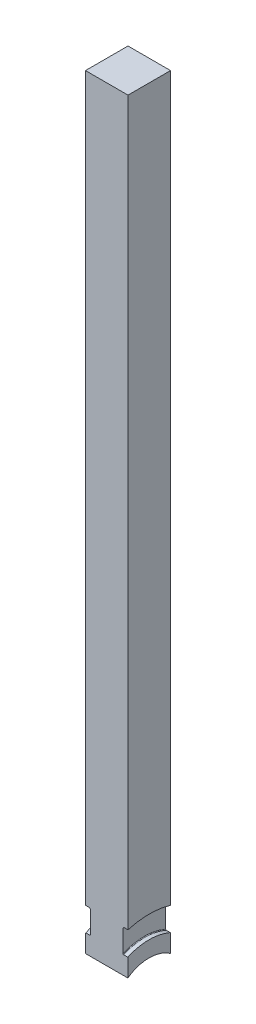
SolidWorks part; units mm, degrees
ref_plane "Front Plane" through (0, 0, 0) normal (0, 0, 1) x (1, 0, 0)
ref_plane "Top Plane" through (0, 0, 0) normal (0, 1, 0) x (1, 0, 0)
ref_plane "Right Plane" through (0, 0, 0) normal (1, 0, 0) x (0, 0, -1)
sketch "Sketch1" plane through (0, 0, 0) normal (1, 0, 0) x (0, 0, -1)
  line L0 (-12.827, 479.425) -> (-12.827, 0)
  line L1 (0, 249.2329) -> (0, 0) construction
  line L2 (12.827, 479.425) -> (12.827, 0)
  line L3 (-12.827, 479.425) -> (12.827, 479.425)
  line L6 (-12.827, 0) -> (12.827, 0)
  arc A0 (-22.225, 0) -> (22.225, 0) centre (0, 0) cw construction
  dimension "R" = 22.225
  dimension "L" = 457.2
  dimension "T" = 25.654
extrude "Boss-Extrude1" add sketch "Sketch1" along normal mid plane 25.654
sketch "Sketch8" plane through (0, 0, 0) normal (1, 0, 0) x (0, 0, -1)
  circle A0 centre (0, 0) radius 22.225
  arc A1 (22.225, 0) -> (-22.225, 0) centre (0, 0) ccw construction
extrude "Cut-Extrude4" cut sketch "Sketch8" against normal through all both and the other way through all
sketch "Sketch2" plane through (0, 0, 0) normal (0, 0, 1) x (1, 0, 0)
  line L0 (12.827, 31.75) -> (9.8552, 31.75)
  line L1 (12.827, 479.425) -> (12.827, 18.1499) construction
  line L2 (9.8552, 31.75) -> (9.8552, 45.2374)
  line L3 (9.8552, 45.2374) -> (12.827, 45.2374)
  line L4 (12.827, 45.2374) -> (12.827, 31.75)
  line L5 (0, 29.9173) -> (0, 0) construction
  line L6 (-12.827, 45.2374) -> (-12.827, 31.75)
  line L7 (-9.8552, 45.2374) -> (-12.827, 45.2374)
  line L8 (-9.8552, 31.75) -> (-9.8552, 45.2374)
  line L9 (-12.827, 31.75) -> (-9.8552, 31.75)
  line L10 (-8.8482, 0) -> (24.5305, 0) construction
  dimension "D1" = 19.7104
  dimension "D2" = 45.2374
  dimension "D3" = 31.75
revolve "Cut-Revolve1" cut sketch "Sketch2" angle 360 about L10
sketch "Sketch7" plane through (0, 0, 0) normal (0, 0, 1) x (1, 0, 0)
  line L6 (-12.827, 31.75) -> (-12.7, 31.75)
  line L8 (-12.827, 31.75) -> (-12.827, 0)
  line L9 (-12.827, 0) -> (-12.7, 0)
  line L10 (-12.7, 31.75) -> (-12.7, 0)
  line L11 (0, 16.5651) -> (0, 5.9342) construction
  line L12 (12.7, 31.75) -> (12.7, 0)
  line L13 (12.827, 0) -> (12.7, 0)
  line L14 (12.827, 31.75) -> (12.827, 0)
  line L15 (12.827, 31.75) -> (12.7, 31.75)
  dimension "MW" = 25.4
extrude "Cut-Extrude3" cut sketch "Sketch7" against normal through all both and the other way through all
fillet "Fillet1" radius 0.762 2 edges at (-9.8552, 45.2374, 0) (9.8552, 45.2374, 0)
fillet "Fillet2" radius 0.381 2 edges at (-9.8552, 31.75, 0) (9.8552, 31.75, 0)
